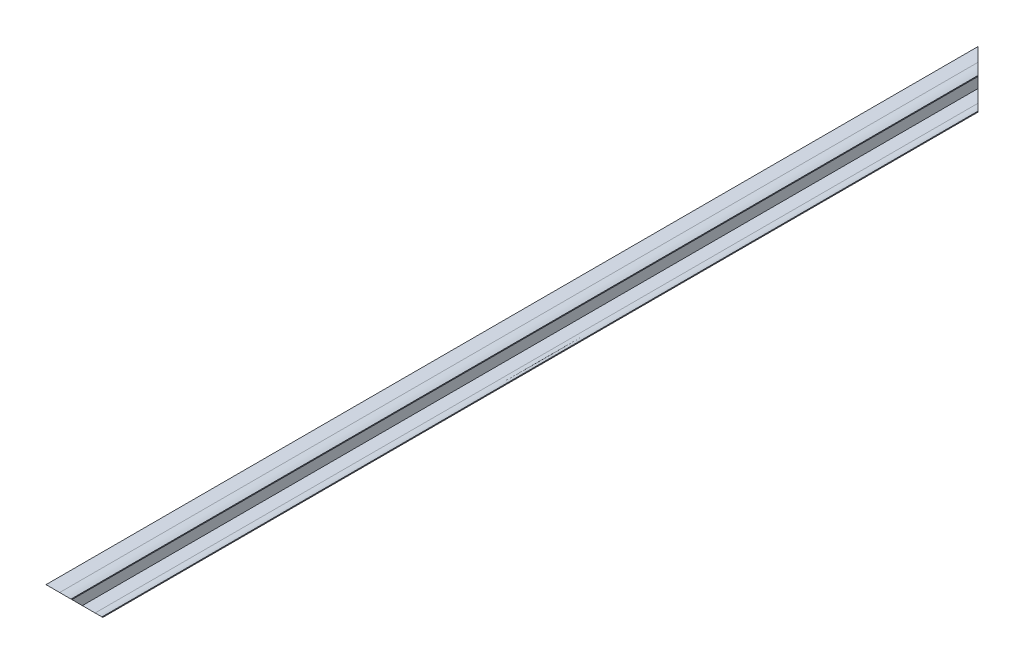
SolidWorks part; units mm, degrees
ref_plane "Plan de face" through (0, 0, 0) normal (0, 0, 1) x (1, 0, 0)
ref_plane "Plan de dessus" through (0, 0, 0) normal (0, 1, 0) x (1, 0, 0)
ref_plane "Plan de droite" through (0, 0, 0) normal (1, 0, 0) x (0, 0, -1)
sketch "Esquisse1" plane through (0, 0, 0) normal (0, 0, 1) x (1, 0, 0)
  line L0 (0, 0) -> (0, 80)
  line L1 (0, 80) -> (30, 80)
  line L2 (0, 40) -> (81.0721, 40) construction
  line L3 (2, 78) -> (2, 2)
  line L4 (0, 0) -> (30, 0)
  line L5 (2, 78) -> (30, 78)
  line L6 (50, 75) -> (50, 73)
  line L7 (50, 5) -> (50, 7)
  line L8 (2, 2) -> (30, 2)
  spline S0 degree 2 poles (30, 80) (40.6033, 79.9515) (50, 75) knots 0 0 0 1 1 1
  spline S1 degree 2 poles (30, 0) (40.6033, 0.0485) (50, 5) knots 0 0 0 1 1 1
  spline S2 degree 2 poles (30, 78) (40.6033, 77.9515) (50, 73) knots 0 0 0 1 1 1
  spline S3 degree 2 poles (30, 2) (40.6033, 2.0485) (50, 7) knots 0 0 0 1 1 1
  point P20 (2, 40)
  dimension "D1" = 80
  dimension "D2" = 30
  dimension "D3" = 5
  dimension "D4" = 50
  dimension "D5" = 1.2
  dimension "D6" = 10
  dimension "D7" = 5
  dimension "D8" = 10
  dimension "D9" = 1.2
  dimension "D10" = 28
  dimension "D11" = 20
  dimension "D12" = 2
  dimension "D13" = 2
extrude "Extrusion1" add sketch "Esquisse1" along normal blind 2050
sketch "Esquisse3" plane through (0, 80, 0) normal (0, 1, 0) x (-1, 0, 0)
  line L0 (0, 0) -> (-50, 50)
  line L1 (-50, 2050) -> (-50, 0) construction
  line L2 (-50, 50) -> (-50, 0)
  line L3 (-50, 0) -> (0, 0)
  dimension "D1" = 45
extrude "Extrusion4" cut sketch "Esquisse3" against normal up to next
sketch "Esquisse4" plane through (0, 0, 0) normal (-1, 0, 0) x (0, 0, 1)
  line L0 (2050, 80) -> (1970, 0)
  line L1 (2050, 0) -> (0, 0) construction
  line L2 (1970, 0) -> (2050, 0)
  line L3 (2050, 0) -> (2050, 80)
  dimension "D1" = 45
extrude "Extrusion5" cut sketch "Esquisse4" against normal up to next
